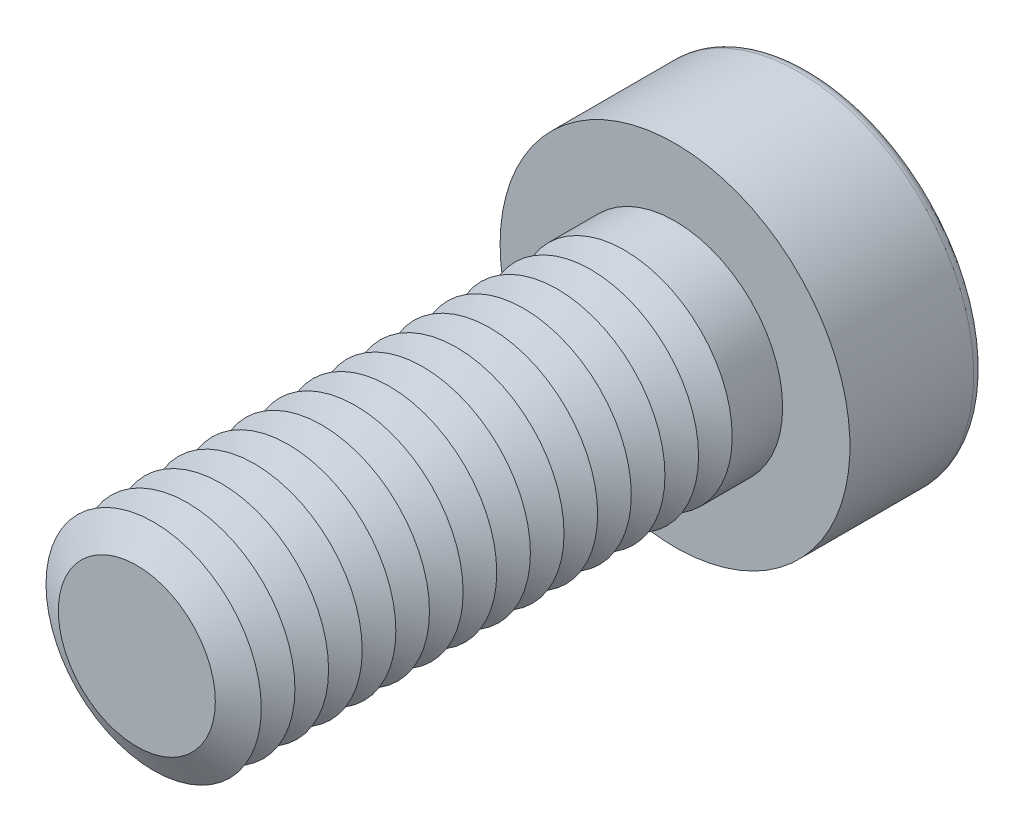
SolidWorks part; units mm, degrees
ref_plane "Front Plane" through (0, 0, 0) normal (0, 0, 1) x (1, 0, 0)
ref_plane "Top Plane" through (0, 0, 0) normal (0, 1, 0) x (1, 0, 0)
ref_plane "Right Plane" through (0, 0, 0) normal (1, 0, 0) x (0, 0, -1)
sketch "Sketch1" plane through (0, 0, 0) normal (0, 0, 1) x (1, 0, 0)
  circle A0 centre (0, 0) radius 4
  dimension "D1" = 8
extrude "Boss-Extrude1" add sketch "Sketch1" along normal blind 20
sketch "Sketch2" plane through (0, 0, 0) normal (0, 0, -1) x (-1, 0, 0)
  circle A0 centre (0, 0) radius 6.5
  dimension "D1" = 13
extrude "Boss-Extrude2" add sketch "Sketch2" along normal blind 5
sketch "Sketch3" plane through (0, 0, -5) normal (0, 0, -1) x (-1, 0, 0)
  line L1 (-1.4434, 2.5) -> (-2.8868, 0)
  line L2 (-2.8868, 0) -> (-1.4434, -2.5)
  line L3 (-1.4434, -2.5) -> (1.4434, -2.5)
  line L4 (1.4434, -2.5) -> (2.8868, 0)
  line L5 (2.8868, 0) -> (1.4434, 2.5)
  line L6 (1.4434, 2.5) -> (-1.4434, 2.5)
  circle A0 centre (0, 0) radius 2.5 construction
  dimension "D1" = 5
extrude "Cut-Extrude1" cut sketch "Sketch3" against normal blind 3.75
fillet "Fillet1" radius 0.4 1 edges at (-6.5, 0, -5)
sketch "Sketch4" plane through (0, 0, -1.25) normal (0, 0, -1) x (-1, 0, 0)
  line L0 (1.4434, -2.5) -> (2.8868, 0) construction
  circle A0 centre (0, 0) radius 2.5
extrude "Cut-Extrude2" cut sketch "Sketch4" against normal through all draft 60
sketch "Sketch5" plane through (0, 0, -5) normal (0, 0, -1) x (-1, 0, 0)
  circle A0 centre (0, 0) radius 2.8868
extrude "Cut-Extrude3" cut sketch "Sketch5" against normal through all draft 75
sketch "Sketch7" plane through (0, 0, 0) normal (1, 0, 0) x (0, 0, -1)
  line L25 (-20, 2.9175) -> (-19.375, 4)
  line L26 (-20, 4) -> (-20, -4) construction
  line L27 (-19.375, 4) -> (-20.625, 4)
  line L28 (-20.625, 4) -> (-20, 2.9175)
  line L29 (0, 4) -> (-20, 4) construction
  dimension "D1" = 1.25
revolve "Cut-Revolve1" cut sketch "Sketch7" angle 360 about axis through (0, 0, 20) along (0, 0, -1)
pattern_linear "LPattern1" count 15 spacing 1.25 along (0, 0, -1) of "Cut-Revolve1"
